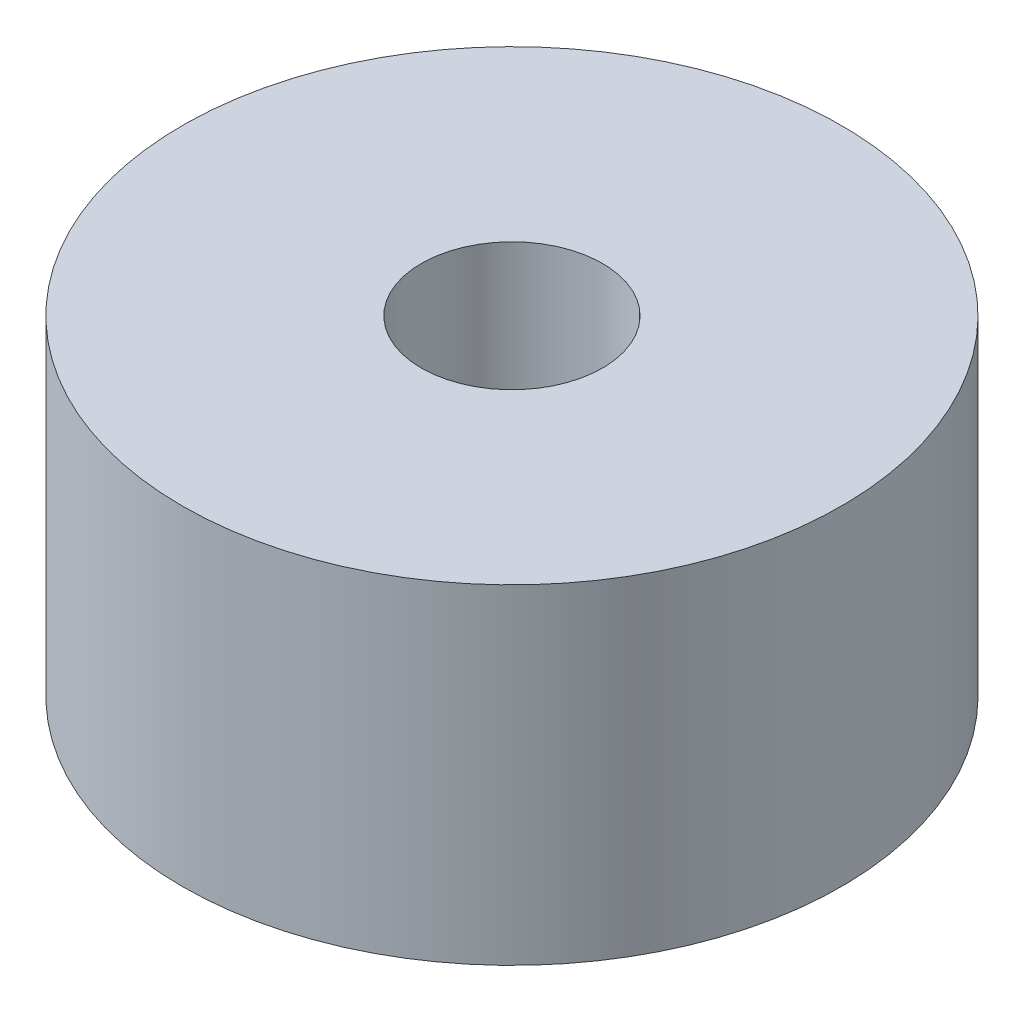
SolidWorks part; units mm, degrees
ref_plane "Ebene vorne" through (0, 0, 0) normal (0, 0, 1) x (1, 0, 0)
ref_plane "Ebene oben" through (0, 0, 0) normal (0, 1, 0) x (1, 0, 0)
ref_plane "Ebene rechts" through (0, 0, 0) normal (1, 0, 0) x (0, 0, -1)
sketch "Skizze1" plane through (0, 0, 0) normal (0, 1, 0) x (1, 0, 0)
  line L0 (0, 35.4563) -> (0, -32.854) construction
  line L1 (-40.4982, 0) -> (35.9442, 0) construction
  circle A0 centre (0, 0) radius 13 construction
  circle A1 centre (-4.5, 0) radius 4
  circle A2 centre (-4.5, 0) radius 8 construction
  circle A3 centre (-4.5, 0) radius 1.1
  dimension "D1" = 26
  dimension "D2" = 8
  dimension "D4" = 16
  dimension "D5" = 2.2
  dimension "D3" = 4.5
extrude "Aufsatz-Linear austragen1" add sketch "Skizze1" along normal blind 4
